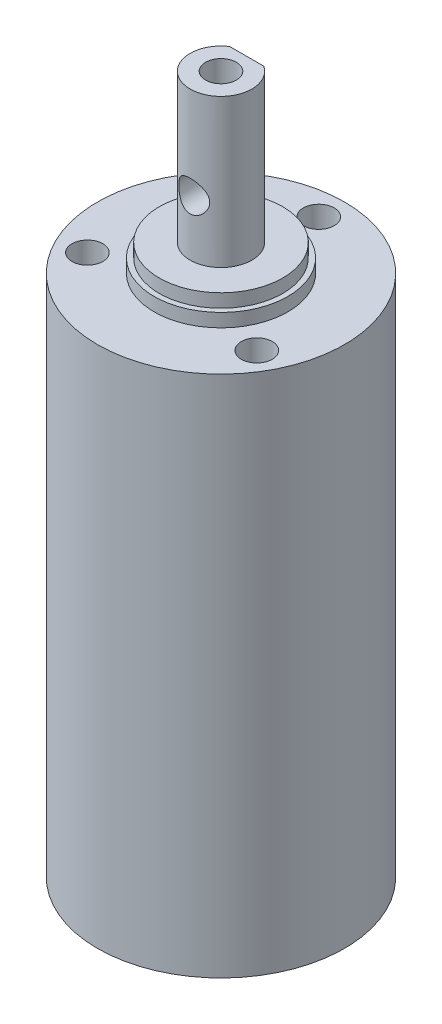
SolidWorks part; units mm, degrees
ref_plane "前视基准面" through (0, 0, 0) normal (0, 0, 1) x (1, 0, 0)
ref_plane "上视基准面" through (0, 0, 0) normal (0, 1, 0) x (1, 0, 0)
ref_plane "右视基准面" through (0, 0, 0) normal (1, 0, 0) x (0, 0, -1)
sketch "草图2" plane through (0, 0, 0) normal (0, 0, 1) x (1, 0, 0)
  line L0 (0, 0) -> (3, 0)
  line L1 (3, 0) -> (3, 4)
  line L2 (0, 0) -> (0, 71.8)
  line L3 (0, 71.8) -> (3, 71.8)
  line L4 (3, 71.8) -> (3, 57.4)
  line L5 (0, 57.4) -> (6, 57.4)
  line L6 (6, 57.4) -> (6, 56.1)
  line L7 (0, 56.1) -> (6.5, 56.1)
  line L8 (6.5, 56.1) -> (6.5, 54.8)
  line L9 (0, 54.8) -> (12, 54.8)
  line L10 (12, 54.8) -> (12, 42.6)
  line L11 (12, 42.6) -> (12, 4)
  line L12 (12, 4) -> (0, 4)
  point P15 (12, 48.7)
  dimension "D1" = 38.6
  dimension "D2" = 12
  dimension "D3" = 3
  dimension "D4" = 4
  dimension "D5" = 12.2
  dimension "D6" = 1.3
  dimension "D7" = 1.3
  dimension "D8" = 6
  dimension "D9" = 6.5
  dimension "D10" = 14.4
  dimension "D11" = 3
revolve "旋转1" add sketch "草图2" angle 360 about L2
sketch "草图3" plane through (0, 71.8, 0) normal (0, 1, 0) x (1, 0, 0)
  line L0 (-1.6583, 2.5) -> (1.6583, 2.5)
  circle A0 centre (0, 0) radius 3 construction
  circle A1 centre (0, 0) radius 3 construction
  dimension "D1" = 2.5
extrude "切除-拉伸1" cut sketch "草图3" against normal blind 14.4 and the other way through all
sketch "草图4" plane through (0, 0, -2.5) normal (0, 0, -1) x (-1, 0, 0)
  line L0 (-1.6583, 71.8) -> (1.6583, 71.8) construction
  circle A0 centre (0, 62.8) radius 1.5
  point P4 (0, 71.8)
  dimension "D2" = 3
  dimension "D1" = 9
extrude "切除-拉伸2" cut sketch "草图4" against normal through all
sketch "草图5" plane through (0, 71.8, 0) normal (0, 1, 0) x (1, 0, 0)
  circle A0 centre (0, 0) radius 1.5
  dimension "D1" = 3
extrude "切除-拉伸3" cut sketch "草图5" against normal blind 5.5
sketch "草图6" plane through (0, 54.8, 0) normal (0, 1, 0) x (1, 0, 0)
  circle A0 centre (0, 9.5) radius 1.5
  circle A1 centre (0, 0) radius 6.5 construction
  circle A2 centre (8.2272, -4.75) radius 1.5
  circle A3 centre (-8.2272, -4.75) radius 1.5
  point P11 (0, 0)
  dimension "D1" = 3
  dimension "D2" = 9.5
  dimension "D3" = 3
extrude "切除-拉伸4" cut sketch "草图6" against normal blind 4
